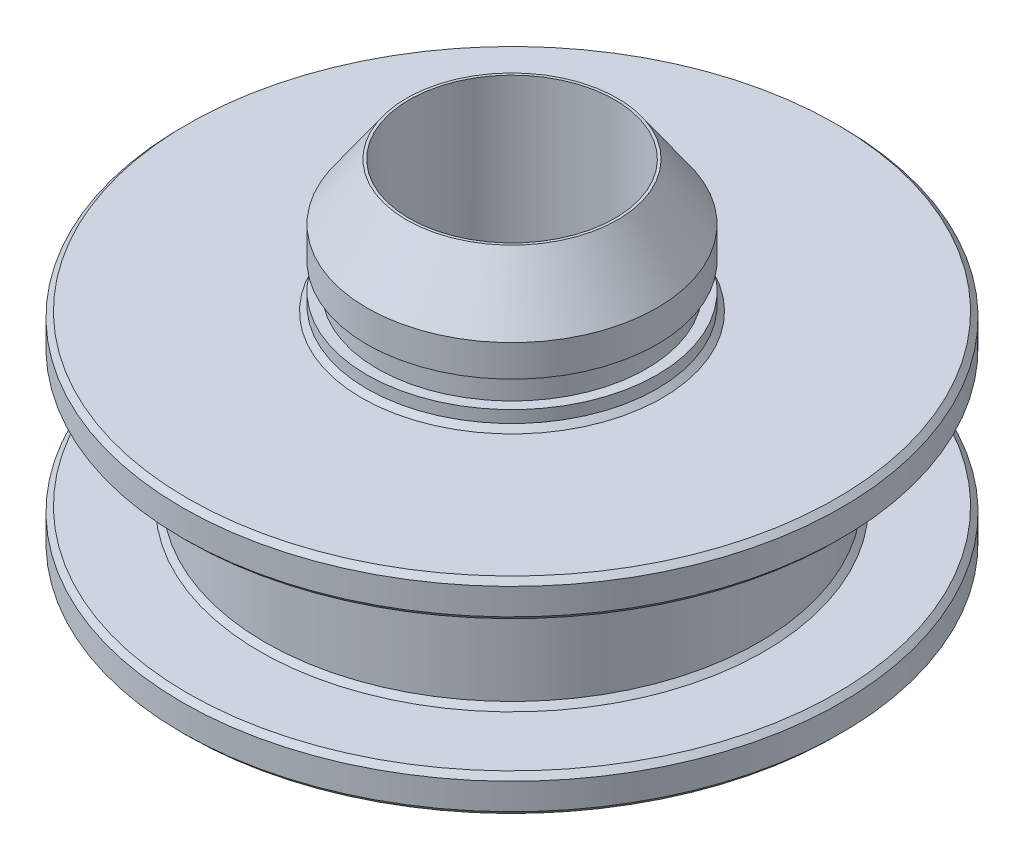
SolidWorks part; units mm, degrees
ref_plane "Front" through (0, 0, 0) normal (0, 0, 1) x (1, 0, 0)
ref_plane "Top" through (0, 0, 0) normal (0, 1, 0) x (1, 0, 0)
ref_plane "Right" through (0, 0, 0) normal (1, 0, 0) x (0, 0, -1)
sketch "Sketch1" plane through (0, 0, 0) normal (0, 1, 0) x (1, 0, 0)
  circle A0 centre (0, 0) radius 5.9436
  dimension "D1" = 11.8872
extrude "Extrude1" add sketch "Sketch1" along normal blind 3.175
sketch "Sketch2" plane through (0, 3.175, 0) normal (0, 1, 0) x (-1, 0, 0)
  circle A0 centre (0, 0) radius 7.9375
  dimension "D1" = 15.875
extrude "Extrude2" add sketch "Sketch2" along normal blind 0.889
sketch "Sketch3" plane through (0, 4.064, 0) normal (0, 1, 0) x (-1, 0, 0)
  circle A0 centre (0, 0) radius 3.4925
  dimension "D1" = 6.985
extrude "Extrude3" add sketch "Sketch3" along normal blind 3.175
sketch "Sketch4" plane through (0, 0, 0) normal (0, 0, 1) x (1, 0, 0)
  line L0 (-2.54, 7.239) -> (-3.4925, 5.8787)
  line L1 (-3.4925, 5.8787) -> (-3.4925, 7.239)
  line L2 (-3.4925, 7.239) -> (-2.54, 7.239)
  line L3 (-3.4925, 5.1167) -> (-3.4925, 4.4817)
  line L4 (-3.4925, 4.4817) -> (-3.2385, 4.4817)
  line L5 (-3.2385, 4.4817) -> (-3.2385, 5.1167)
  line L6 (-3.2385, 5.1167) -> (-3.4925, 5.1167)
  dimension "D1" = 35
  dimension "D2" = 2.54
  dimension "D3" = 0.762
  dimension "D4" = 0.635
  dimension "D5" = 0.254
revolve "Cut-Revolve1" cut sketch "Sketch4" angle 360 about axis through (0, 7.239, 0) along (0, -1, 0)
sketch "Sketch7" plane through (0, 0, 0) normal (0, -1, 0) x (1, 0, 0)
  circle A0 centre (0, 0) radius 7.9375
  circle A2 centre (0, 0) radius 7.9375 construction
extrude "Extrude4" add sketch "Sketch7" along normal blind 0.889
sketch "Sketch8" plane through (0, -0.889, 0) normal (0, -1, 0) x (1, 0, 0)
  circle A0 centre (0, 0) radius 4.445
  dimension "D1" = 8.89
extrude "Extrude5" add sketch "Sketch8" along normal blind 1.016
sketch "Sketch5" plane through (0, 7.239, 0) normal (0, 1, 0) x (-1, 0, 0)
  circle A0 centre (0, 0) radius 2.4765
  dimension "D1" = 4.953
extrude "Cut-Extrude1" cut sketch "Sketch5" against normal through all
chamfer "Chamfer2" distance 0.127 angle 45 10 edges at (0, 4.064, 3.4925) (0, 0, -5.9436) (0, 0, -7.9375) (0, -0.889, -7.9375) (0, -0.889, -4.445) (0, -1.905, -4.445) (0, -1.905, 2.4765) (0, 3.175, 5.9436) (0, 3.175, 7.9375) (0, 4.064, 7.9375)
